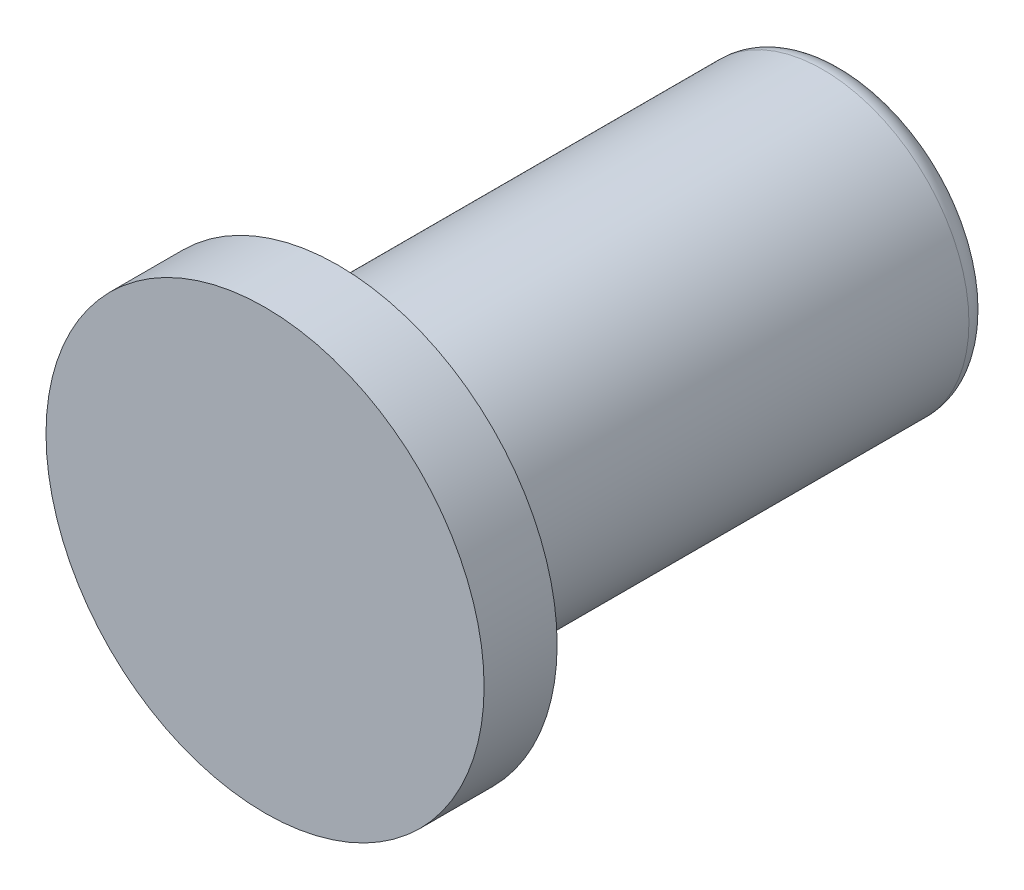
SolidWorks part; units mm, degrees
ref_plane "Front Plane" through (0, 0, 0) normal (0, 0, 1) x (1, 0, 0)
ref_plane "Top Plane" through (0, 0, 0) normal (0, 1, 0) x (1, 0, 0)
ref_plane "Right Plane" through (0, 0, 0) normal (1, 0, 0) x (0, 0, -1)
sketch "Sketch1" plane through (0, 0, 0) normal (1, 0, 0) x (0, 0, -1)
  line L0 (0, 0) -> (27.7, 0) construction
  line L1 (0, 0) -> (0, 15)
  line L2 (0, 15) -> (5, 15)
  line L3 (5, 15) -> (5, 10)
  line L4 (5, 10) -> (38.2, 10)
  line L5 (39.7, 8.5) -> (39.7, 4.5)
  line L6 (39.2, 4) -> (30.7, 4)
  line L7 (30.7, 4) -> (28.3906, 0)
  line L8 (0, 0) -> (28.3906, 0)
  line L9 (39.7, 4.5) -> (39.2, 4)
  arc A0 (38.2, 10) -> (39.7, 8.5) centre (38.2, 8.5) cw
  point P13 (39.7, 10)
  dimension "D10" = 1.5
  dimension "D1" = 10
  dimension "D2" = 15
  dimension "D3" = 5
  dimension "D4" = 34.7
  dimension "D5" = 0.5
  dimension "D6" = 45
  dimension "D7" = 4
  dimension "D8" = 60
  dimension "D9" = 9
revolve "Revolve1" add sketch "Sketch1" angle 360 about L0
